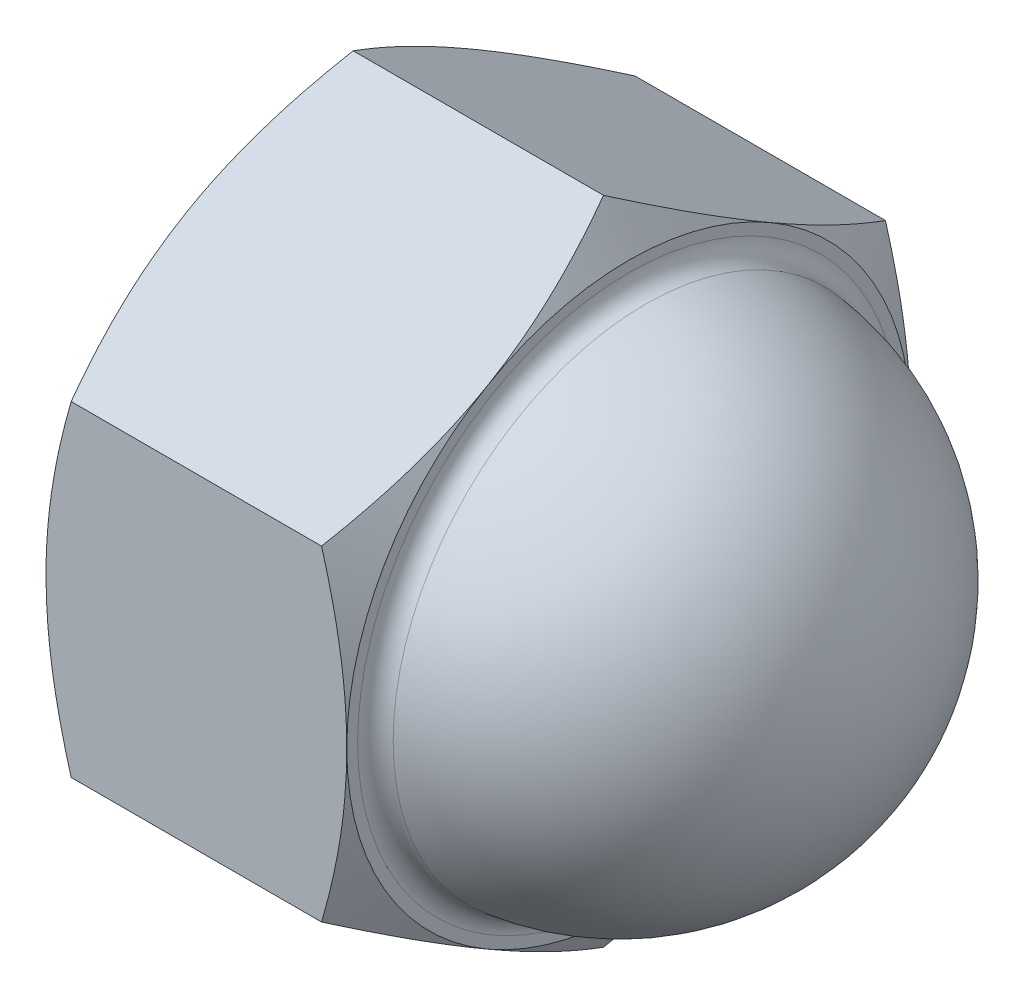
SolidWorks part; units mm, degrees
ref_plane "Plane1" through (0, 0, 0) normal (0, 0, 1) x (1, 0, 0)
ref_plane "Plane2" through (0, 0, 0) normal (0, 1, 0) x (1, 0, 0)
ref_plane "Plane3" through (0, 0, 0) normal (1, 0, 0) x (0, 0, -1)
sketch "BaseNutSke" plane through (0, 0, 0) normal (1, 0, 0) x (0, 0, -1)
  line L6 (15, 8.6603) -> (15, -8.6603)
  line L7 (-15, 8.6603) -> (-15, -8.6603)
  line L8 (15, 8.6603) -> (0, 17.3205)
  line L9 (0, 17.3205) -> (-15, 8.6603)
  line L10 (-15, -8.6603) -> (0, -17.3205)
  line L11 (0, -17.3205) -> (15, -8.6603)
  dimension "D4" = 60
  dimension "D1" = 120
  dimension "D2" = 15
  dimension "D3" = 15
  dimension "Width_flats" = 30
extrude "BaseNut" add sketch "BaseNutSke" along normal blind 16
sketch "DomeSke" plane through (0, 0, 0) normal (0, 0, 1) x (1, 0, 0)
  line L0 (0, 0) -> (63.5, 0) construction
  line L2 (29, 0) -> (27.4, 0)
  line L3 (0, 13.5) -> (15.5, 13.5)
  line L5 (0, 13.5) -> (0, 11.9)
  line L8 (0, 11.9) -> (15.5, 11.9)
  arc A0 (15.5, 13.5) -> (29, 0) centre (15.5, 0) cw
  arc A1 (15.5, 11.9) -> (27.4, 0) centre (15.5, 0) cw
  dimension "Dome_rad" = 13.5
  dimension "Overall_ht" = 29
  dimension "Dome_thk" = 1.6
revolve "Dome" add sketch "DomeSke" angle 360 about L0
sketch "Sketch4" plane through (0, 0, 0) normal (0, 0, 1) x (1, 0, 0)
  line L0 (0, 15) -> (2.7831, 19.8205)
  line L1 (16, 15) -> (13.2169, 19.8205)
  line L2 (2.7831, 19.8205) -> (13.2169, 19.8205)
  line L3 (16, 15) -> (18, 15)
  line L4 (18, 15) -> (18, 30)
  line L5 (18, 30) -> (-2, 30)
  line L6 (0, 15) -> (-2, 15)
  line L7 (-2, 15) -> (-2, 30)
  line L8 (16, 17.3205) -> (16, 8.6603) construction
  line L9 (0, 17.3205) -> (0, 8.6603) construction
  line L10 (0, 0) -> (57.15, 0) construction
  line L11 (16, 17.3205) -> (0, 17.3205) construction
  point P17 (16, 15)
  dimension "D1" = 30
  dimension "D2" = 30
  dimension "D3" = 2
  dimension "D4" = 2
  dimension "D5" = 2.5
  dimension "D6" = 15
  dimension "D7" = 15
revolve "DoubleChamfer" cut sketch "Sketch4" angle 360 about L10
sketch "TapDriSke" plane through (0, 0, 0) normal (0, 0, 1) x (1, 0, 0)
  line L0 (0, 0) -> (44.45, 0) construction
  line L1 (0, 8.75) -> (21.4, 8.75)
  line L2 (0, 12.9904) -> (0, 0) construction
  line L3 (21.4, 8.75) -> (26.6575, 0)
  line L4 (0, 0) -> (63.5, 0) construction
  line L5 (26.6575, 0) -> (0, 0)
  line L6 (0, 0) -> (0, 8.75)
  line L7 (21.4, -8.75) -> (26.6575, 0) construction
  line L8 (0, -8.75) -> (21.4, -8.75) construction
  line L9 (0.5, 6.35) -> (0.5, 3.175) construction
  dimension "TPA" = 118
  dimension "Thread_min" = 17.5
  dimension "Drill_depth" = 21.4
  dimension "Drill_clr" = 1
revolve "TapDrill" cut sketch "TapDriSke"
revolve "EndChamfer" cut sketch "EndChamferSketch" angle 360 about L4
sketch "EndChamferSketch" plane through (0, 0, 0) normal (0, 0, 1) x (1, 0, 0)
  line L0 (-0.0746, 10) -> (0.0254, 10)
  line L1 (0.0254, 10) -> (0.9882, 8.625)
  line L2 (0.9882, 8.625) -> (-0.0746, 8.625)
  line L3 (-0.0746, 8.625) -> (-0.0746, 10)
  line L4 (0, 0) -> (-15.875, 0) construction
  line L5 (15.9746, 10) -> (16.1, 10)
  line L6 (16.1, 10) -> (16.1, 8.625)
  line L7 (16.1, 8.625) -> (15.0118, 8.625)
  line L8 (15.0118, 8.625) -> (15.9746, 10)
  line L9 (16, -12.9904) -> (16, 0) construction
  dimension "D1" = 0.1
  dimension "D2" = 35
  dimension "D3" = 0.0254
  dimension "ChamferDepth" = 1.375
  dimension "ThreadMajor" = 10
  dimension "D4" = 35
  dimension "D5" = 0.1
  dimension "D6" = 0.0254
sketch "ThdSchSke" plane through (0, 0, 0) normal (0, 1, 0) x (1, 0, 0)
  line L0 (0.0381, 10) -> (-0.8372, 8.75)
  line L1 (-0.8372, 8.75) -> (-0.8372, 4.375)
  line L2 (-0.8372, 4.375) -> (0.9134, 4.375)
  line L3 (0.9134, 4.375) -> (0.9134, 8.75)
  line L4 (0.9134, 8.75) -> (0.0381, 10)
  line L5 (-38.1, 0) -> (3.175, 0) construction
  line L6 (0, 0) -> (-15.875, 0) construction
  line L7 (0, 0) -> (63.5, 0) construction
  line L9 (2.5381, 0.475) -> (2.5381, -5.875) construction
  dimension "D1" = 0.0381
  dimension "VeeAngle" = 70
  dimension "SideAngle" = 55
  dimension "Thread_major" = 20
  dimension "Tap_drill" = 17.5
  dimension "OverCut" = 8.75
  dimension "Advance" = 2.5
revolve "ThreadSchematic" [suppressed] cut sketch "ThdSchSke" angle 360 about L5
pattern_linear "ThdSchPat" [suppressed]
fillet "DomeFillet" radius 1 1 edges at (16, 0, 13.4907)
equation "' \"Width_flats@BaseNutSke\" = 30"
equation "' \"Hex_ht@BaseNut\" = 16"
equation "' \"Overall_ht@DomeSke\" = 29"
equation "' \"Dome_rad@DomeSke\" = 13.5"
equation "' \"Thread_min@TapDriSke\" = 17.5"
equation "' \"Drill_clr@TapDriSke\" = 1.0"
equation "' \"Advance@ThdSchSke\" = 2.5"
equation "' \"Thread_nominal@ThreadCosmetic\" = 20"
equation "' \"Radius@DomeFillet\" = 1.0"
equation "' \"Dome_thk@DomeSke\" = 1.6"
equation "\"Drill_depth@TapDriSke\" = \"Overall_ht@DomeSke\"  - \"Dome_thk@DomeSke\"- 0.3 * \"Thread_nominal@ThreadCosmetic\""
equation "\"Thread_depth@ThreadCosmetic\" = \"Thread_nominal@ThreadCosmetic\""
equation "\"D2@BaseNutSke\" = \"Width_flats@BaseNutSke\" / 2"
equation "\"D3@BaseNutSke\" = \"Width_flats@BaseNutSke\" / 2"
equation "\"D7@Sketch4\" = \"Width_flats@BaseNutSke\" / 2"
equation "\"D5@Sketch4\" = \"Width_flats@BaseNutSke\" / 12"
equation "\"Thread_major@ThdSchSke\" = \"Thread_nominal@ThreadCosmetic\""
equation "\"Tap_drill@ThdSchSke\" = \"Thread_min@TapDriSke\""
equation "\"Overcut@ThdSchSke\" = \"Tap_drill@ThdSchSke\" * 0.5"
equation "\"Num_threads@ThdSchPat\" = int(  ( \"Hex_ht@BaseNut\" - 0.002 ) / \"Advance@ThdSchSke\" + 0.999 )  + 1"
equation "' \"Num_threads@ThdSchPat\" = int(  ( \"Thread_depth@ThreadCosmetic\" - 0.002 ) / \"Advance@ThdSchSke\" + 0.999 )  + 1"
equation "\"Advance@ThdSchPat\" = ( \"Hex_ht@BaseNut\" - 0.002 ) /  (\"Num_threads@ThdSchPat\" - 1) 'relax it"
equation "' \"Advance@ThdSchPat\" = ( \"Thread_depth@ThreadCosmetic\" - 0.002 ) /  (\"Num_threads@ThdSchPat\" - 1) 'relax it"
equation "\"ThreadMajor@EndChamferSketch\" = \"Thread_nominal@ThreadCosmetic\" * 0.5"
equation "\"ChamferDepth@EndChamferSketch\" = (\"Thread_nominal@ThreadCosmetic\" - \"Thread_min@TapDriSke\") * 0.55"
